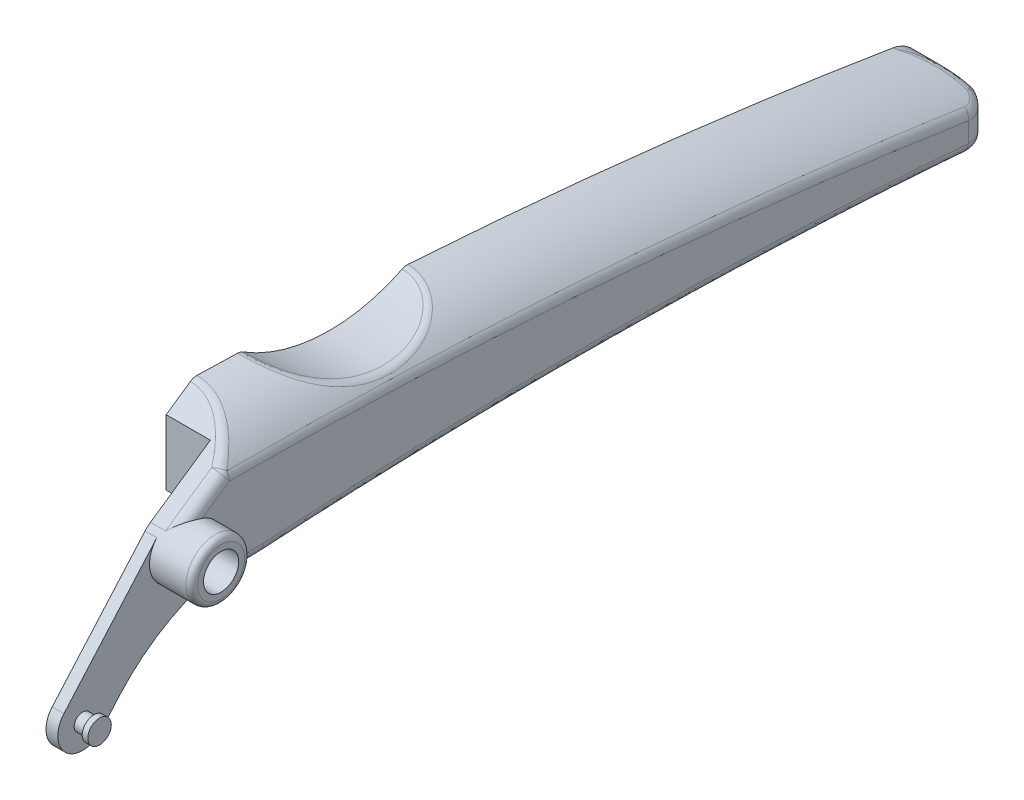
SolidWorks part; units mm, degrees
ref_plane "Front Plane" through (0, 0, 0) normal (0, 0, 1) x (1, 0, 0)
ref_plane "Top Plane" through (0, 0, 0) normal (0, 1, 0) x (1, 0, 0)
ref_plane "Right Plane" through (0, 0, 0) normal (1, 0, 0) x (0, 0, -1)
body saved out of another part "Stock-Handle_&-1"
